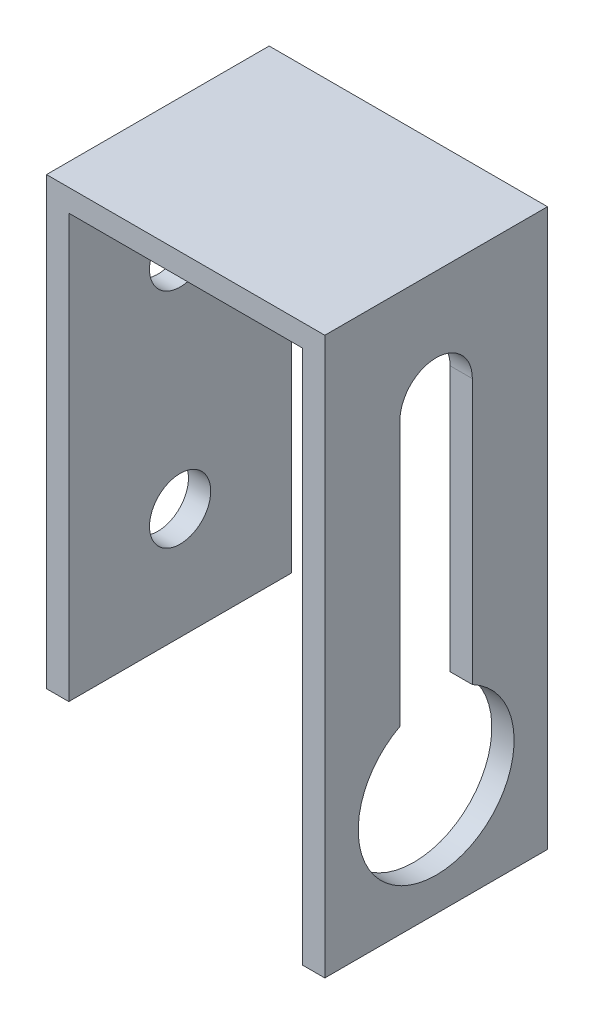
SolidWorks part; units mm, degrees
ref_plane "前基準面" through (0, 0, 0) normal (0, 0, 1) x (1, 0, 0)
ref_plane "上基準面" through (0, 0, 0) normal (0, 1, 0) x (1, 0, 0)
ref_plane "右基準面" through (0, 0, 0) normal (1, 0, 0) x (0, 0, -1)
sketch "草圖1" plane through (0, 0, 0) normal (0, 0, 1) x (1, 0, 0)
  line L0 (0, 0) -> (0, 40)
  line L1 (0, 40) -> (25, 40)
  line L2 (25, 40) -> (25, -10)
  line L3 (2, 0) -> (2, 38)
  line L4 (2, 38) -> (23, 38)
  line L5 (23, 38) -> (23, -10)
  line L6 (2, 0) -> (0, 0)
  line L7 (25, -10) -> (23, -10)
  dimension "D1" = 50
  dimension "D2" = 40
  dimension "D3" = 25
  dimension "D4" = 2
extrude "填料-伸長1" add sketch "草圖1" along normal blind 20
sketch "草圖2" plane through (25, 0, 0) normal (1, 0, 0) x (0, 0, -1)
  line L0 (-10, 30) -> (-10, 0) construction
  line L1 (-6.75, 30) -> (-6.75, 0)
  line L2 (-13.25, 30) -> (-13.25, 0)
  line L3 (-20, -10) -> (-20, 40) construction
  line L4 (-20, -10) -> (0, -10) construction
  arc A0 (-6.75, 30) -> (-13.25, 30) centre (-10, 30) ccw
  arc A1 (-13.25, 0) -> (-6.75, 0) centre (-10, 0) ccw
  point P2 (-10, 15)
  dimension "D4" = 3.25
  dimension "D1" = 30
  dimension "D2" = 10
  dimension "D3" = 25
extrude "除料-伸長1" cut sketch "草圖2" against normal blind 2
sketch "草圖3" plane through (25, 0, 0) normal (1, 0, 0) x (0, 0, -1)
  circle A0 centre (-10, 0) radius 7
  dimension "D1" = 14
extrude "除料-伸長2" cut sketch "草圖3" against normal up to next
sketch "草圖4" plane through (2, 0, 0) normal (1, 0, 0) x (0, 0, -1)
  line L0 (-20, 0) -> (0, 0) construction
  line L1 (-20, 0) -> (-20, 38) construction
  circle A0 centre (-10, 30) radius 2.75
  circle A1 centre (-10, 10) radius 2.75
  dimension "D1" = 5.5
  dimension "D2" = 5.5
  dimension "D3" = 20
  dimension "D4" = 10
  dimension "D5" = 10
extrude "除料-伸長3" cut sketch "草圖4" against normal up to next
